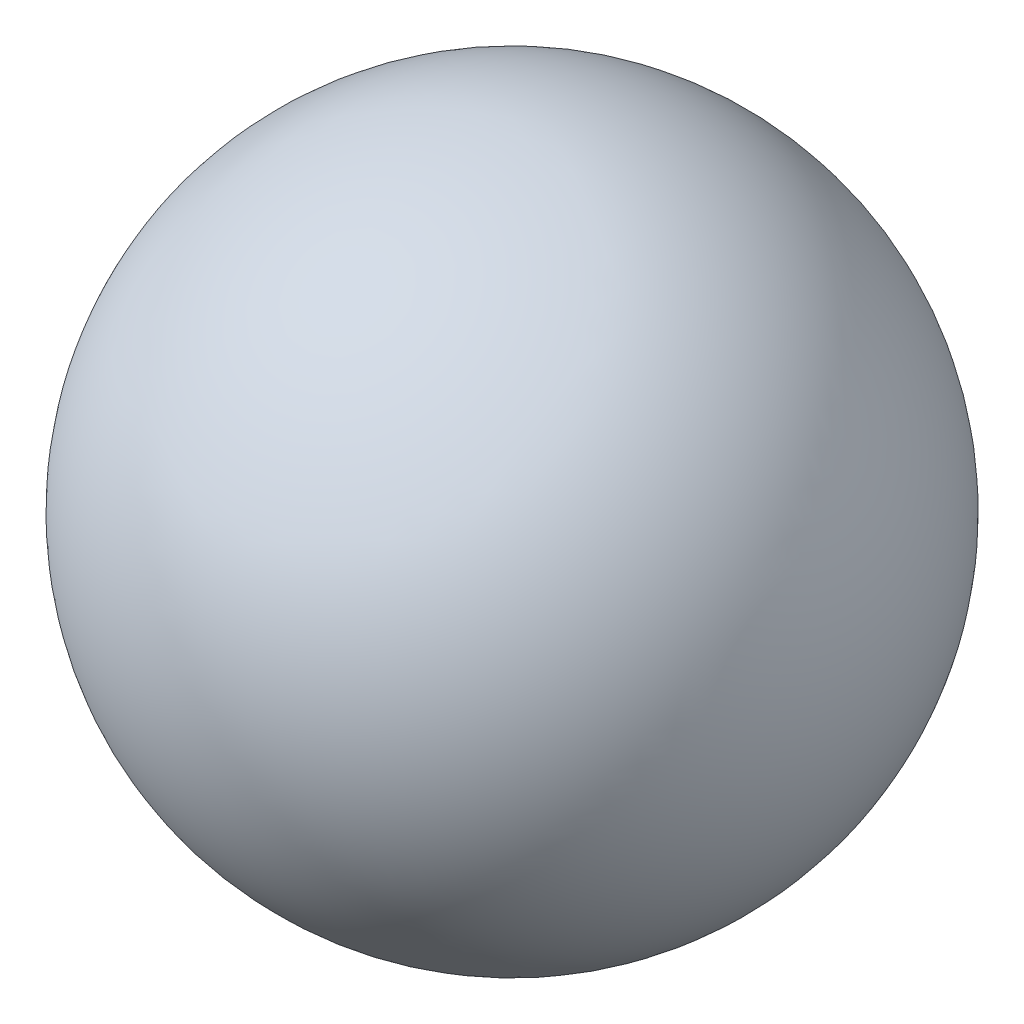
SolidWorks part; units mm, degrees
ref_plane "前视基准面" through (0, 0, 0) normal (0, 0, 1) x (1, 0, 0)
ref_plane "上视基准面" through (0, 0, 0) normal (0, 1, 0) x (1, 0, 0)
ref_plane "右视基准面" through (0, 0, 0) normal (1, 0, 0) x (0, 0, -1)
other "Configuration Table"
sketch "草图1" plane through (0, 0, 0) normal (0, 0, 1) x (1, 0, 0)
  line L0 (8.7716, 13.3024) -> (-4.4902, 13.3024) construction
  line L1 (-0.0837, 13.3024) -> (4.9163, 13.3024)
  arc A0 (4.9163, 13.3024) -> (-0.0837, 13.3024) centre (2.4163, 13.3024) ccw
  dimension "D1" = 5
revolve "旋转1" add sketch "草图1" angle 360 about L0
